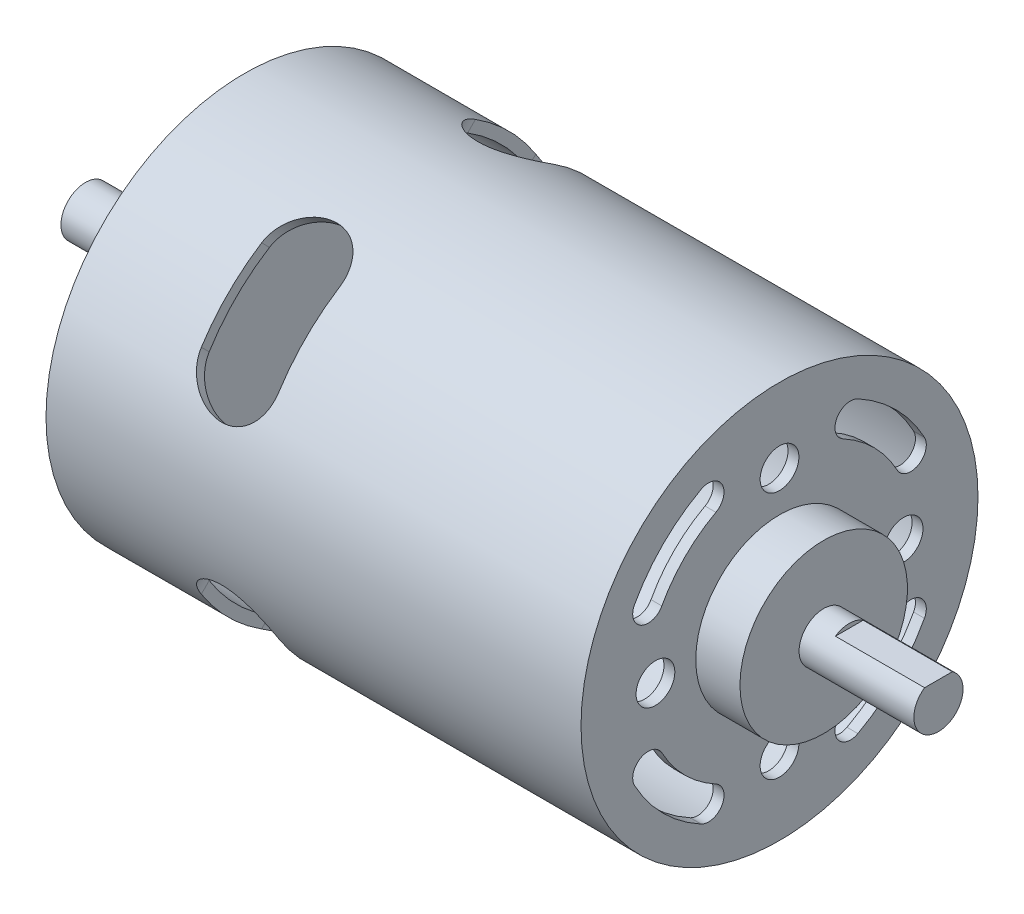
SolidWorks part; units mm, degrees
ref_plane "Front" through (0, 0, 0) normal (0, 0, 1) x (1, 0, 0)
ref_plane "Top" through (0, 0, 0) normal (0, 1, 0) x (1, 0, 0)
ref_plane "Right" through (0, 0, 0) normal (1, 0, 0) x (0, 0, -1)
sketch "Esquisse3" plane through (0, 0, 0) normal (0, 0, 1) x (1, 0, 0)
  line L0 (0, 0) -> (69, 0) construction
  line L1 (0, 0) -> (0, 25.6)
  line L2 (0, 25.6) -> (69, 25.6)
  line L3 (69, 25.6) -> (69, 0)
  dimension "D1" = 69
  dimension "D2" = 51.2
revolve "Révol.-Mince1" add sketch "Esquisse3" angle 360 about L0
sketch "Esquisse4" plane through (69, 0, 0) normal (1, 0, 0) x (0, 0, -1)
  line L0 (0, 0) -> (0, 16) construction
  line L1 (0, 0) -> (0, 16) construction
  line L2 (0, 0) -> (16, 0) construction
  line L3 (-13.6118, 13.6118) -> (0, 0) construction
  circle A0 centre (0, 16) radius 2.5
  circle A1 centre (16, 0) radius 2.5
  circle A2 centre (0, -16) radius 2.5
  circle A3 centre (-16, 0) radius 2.5
  circle A4 centre (0, 0) radius 19.25 construction
  arc A5 (-16.9335, 9.1553) -> (-9.1553, 16.9335) centre (0, 0) cw construction
  arc A6 (-10.1065, 18.6928) -> (-18.6928, 10.1065) centre (0, 0) ccw
  arc A7 (-8.2041, 15.1742) -> (-15.1742, 8.2041) centre (0, 0) ccw
  arc A8 (-8.2041, 15.1742) -> (-10.1065, 18.6928) centre (-9.1553, 16.9335) ccw
  arc A9 (-18.6928, 10.1065) -> (-15.1742, 8.2041) centre (-16.9335, 9.1553) ccw
  arc A10 (9.1553, 16.9335) -> (16.9335, 9.1553) centre (0, 0) cw construction
  arc A11 (18.6928, 10.1065) -> (10.1065, 18.6928) centre (0, 0) ccw
  arc A12 (15.1742, 8.2041) -> (8.2041, 15.1742) centre (0, 0) ccw
  arc A13 (15.1742, 8.2041) -> (18.6928, 10.1065) centre (16.9335, 9.1553) ccw
  arc A14 (10.1065, 18.6928) -> (8.2041, 15.1742) centre (9.1553, 16.9335) ccw
  arc A15 (16.9335, -9.1553) -> (9.1553, -16.9335) centre (0, 0) cw construction
  arc A16 (10.1065, -18.6928) -> (18.6928, -10.1065) centre (0, 0) ccw
  arc A17 (8.2041, -15.1742) -> (15.1742, -8.2041) centre (0, 0) ccw
  arc A18 (8.2041, -15.1742) -> (10.1065, -18.6928) centre (9.1553, -16.9335) ccw
  arc A19 (18.6928, -10.1065) -> (15.1742, -8.2041) centre (16.9335, -9.1553) ccw
  arc A20 (-9.1553, -16.9335) -> (-16.9335, -9.1553) centre (0, 0) cw construction
  arc A21 (-18.6928, -10.1065) -> (-10.1065, -18.6928) centre (0, 0) ccw
  arc A22 (-15.1742, -8.2041) -> (-8.2041, -15.1742) centre (0, 0) ccw
  arc A23 (-15.1742, -8.2041) -> (-18.6928, -10.1065) centre (-16.9335, -9.1553) ccw
  arc A24 (-10.1065, -18.6928) -> (-8.2041, -15.1742) centre (-9.1553, -16.9335) ccw
  point P15 (-13.6118, 13.6118)
  point P27 (13.6118, 13.6118)
  point P34 (13.6118, -13.6118)
  point P41 (-13.6118, -13.6118)
  point P46 (0, 0)
  dimension "D1" = 5
  dimension "D5" = 38.5
  dimension "D6" = 21.25
  dimension "D2" = 16
  dimension "D4" = 90
  dimension "D7" = 11
  dimension "D8" = 45
  dimension "D3" = 4
  dimension "D9" = 4
extrude "Enlèv. mat.-Extru.2" cut sketch "Esquisse4" against normal up to next
ref_plane "Plan1" through (0, 0, 0) normal (0, 0.7071, -0.7071) x (-1, 0, 0)
sketch "Esquisse5" plane through (0, 0, 0) normal (0, 0.7071, -0.7071) x (1, 0, 0)
  line L0 (21, -5.5) -> (21, 5.5) construction
  line L1 (16, -5.5) -> (16, 5.5)
  line L2 (26, -5.5) -> (26, 5.5)
  arc A0 (16, -5.5) -> (26, -5.5) centre (21, -5.5) ccw
  arc A1 (26, 5.5) -> (16, 5.5) centre (21, 5.5) ccw
  point P2 (21, 0)
  dimension "D1" = 21
  dimension "D2" = 10
  dimension "D3" = 11
extrude "Enlèv. mat.-Extru.3" cut sketch "Esquisse5" against normal through all both and the other way through all
pattern_circular "Répétition circulaire1" count 2 every 90 about axis through (0, 0, 0) along (-1, 0, 0) of "Enlèv. mat.-Extru.3"
sketch "Esquisse6" plane through (0, 0, 0) normal (0, 1, 0) x (1, 0, 0)
  line L0 (-20.9365, 0) -> (86.2797, 0) construction
  line L1 (0, 0) -> (0, 10.5)
  line L2 (0, 25.6) -> (0, -25.6) construction
  line L3 (0, 10.5) -> (-8.5, 10.5)
  line L4 (-8.5, 10.5) -> (-8.5, 3.175)
  line L5 (-8.5, 3.175) -> (-20.5, 3.175)
  line L6 (-20.5, 3.175) -> (-20.5, 0)
  line L7 (0, 0) -> (-20.5, 0)
  dimension "D1" = 8.5
  dimension "D2" = 20.5
  dimension "D3" = 6.35
  dimension "D4" = 21
revolve "Révolution2" add sketch "Esquisse6" angle 360 about L0
sketch "Esquisse7" plane through (0, 0, 0) normal (0, 1, 0) x (1, 0, 0)
  line L0 (0, 0) -> (126.4905, 0) construction
  line L1 (69, 10.8) -> (74.7, 10.8)
  line L2 (69, -25.6) -> (69, 25.6) construction
  line L3 (74.7, 10.8) -> (74.7, 3.175)
  line L4 (74.7, 3.175) -> (89.5, 3.175)
  line L5 (89.5, 3.175) -> (89.5, 0)
  line L6 (69, 10.8) -> (69, 0)
  line L7 (89.5, 0) -> (69, 0)
  dimension "D1" = 6.35
  dimension "D2" = 21.6
  dimension "D3" = 5.7
  dimension "D4" = 14.8
revolve "Révolution3" add sketch "Esquisse7" angle 360 about L0
sketch "Esquisse8" plane through (0, 0, 0) normal (-1, 0, 0) x (0, 0, 1)
  line L0 (0, 0) -> (0, 25.6) construction
  line L1 (18.1019, -18.1019) -> (-18.1019, 18.1019) construction
  line L2 (-16.3695, 13.0461) -> (-16.6524, 13.329)
  line L3 (-16.3695, 13.0461) -> (-13.0461, 16.3695)
  line L4 (-16.6524, 13.329) -> (-13.329, 16.6524)
  line L5 (-13.0461, 16.3695) -> (-13.329, 16.6524)
  line L6 (-16.3695, 13.0461) -> (-13.329, 16.6524) construction
  line L7 (-16.6524, 13.329) -> (-13.0461, 16.3695) construction
  line L8 (0, 0) -> (5.7333, 5.7333) construction
  line L9 (13.329, -16.6524) -> (16.3695, -13.0461) construction
  line L10 (13.0461, -16.3695) -> (16.6524, -13.329) construction
  line L11 (16.3695, -13.0461) -> (16.6524, -13.329)
  line L12 (13.329, -16.6524) -> (16.6524, -13.329)
  line L13 (13.0461, -16.3695) -> (16.3695, -13.0461)
  line L14 (13.0461, -16.3695) -> (13.329, -16.6524)
  circle A0 centre (0, 0) radius 25.6 construction
  point P8 (-14.8492, 14.8492)
  point P18 (14.8492, -14.8492)
  dimension "D1" = 45
  dimension "D2" = 0.4
  dimension "D3" = 4.7
  dimension "D4" = 21
extrude "Boss.-Extru.1" add sketch "Esquisse8" along normal blind 8
sketch "Esquisse9" plane through (89.5, 0, 0) normal (1, 0, 0) x (0, 0, -1)
  line L0 (-1.7861, 2.625) -> (1.7861, 2.625)
  line L1 (0, -3.175) -> (8.2871, -3.175) construction
  circle A0 centre (0, 0) radius 3.175 construction
  circle A1 centre (0, 0) radius 3.175
  arc A2 (1.7861, 2.625) -> (-1.7861, 2.625) centre (0, 0) ccw
  dimension "D2" = 5.8
  dimension "D1" = 0
extrude "Enlèv. mat.-Extru.4" cut sketch "Esquisse9" against normal blind 11.5
